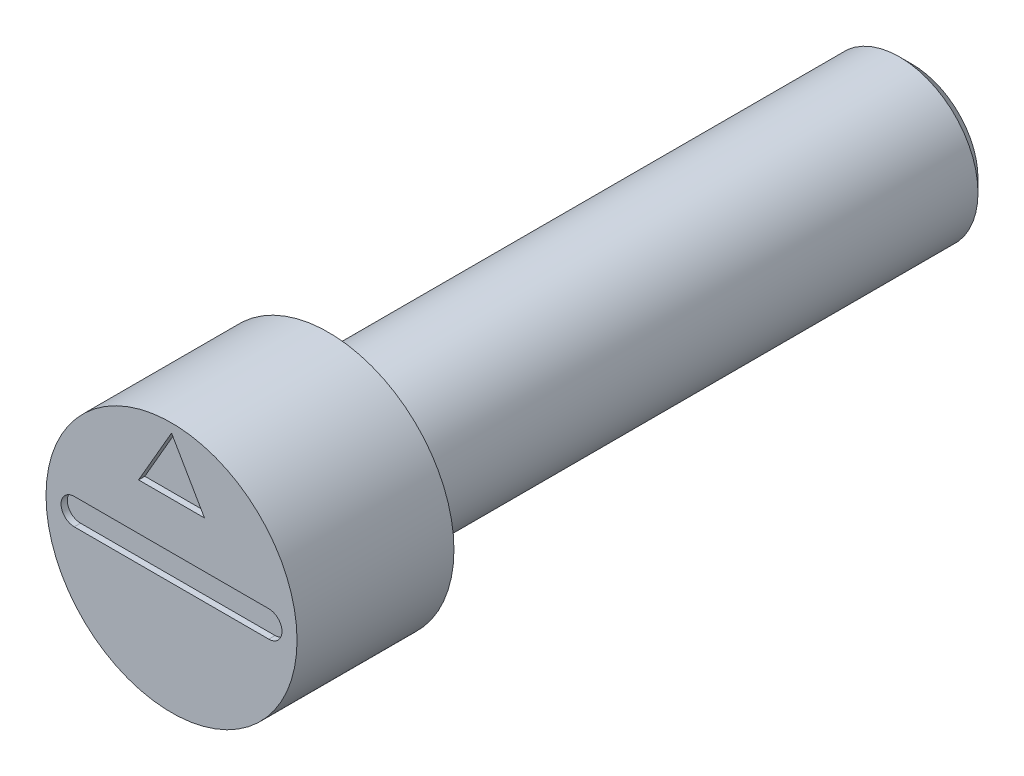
SolidWorks part; units mm, degrees
ref_plane "Front Plane" through (0, 0, 0) normal (0, 0, 1) x (1, 0, 0)
ref_plane "Top Plane" through (0, 0, 0) normal (0, 1, 0) x (1, 0, 0)
ref_plane "Right Plane" through (0, 0, 0) normal (1, 0, 0) x (0, 0, -1)
imported_body "Imported1"
other "DeleteFace1"
sketch "Sketch1" plane through (0, 0, 0) normal (0, 0, 1) x (1, 0, 0)
  line L0 (0, 1.8593) -> (-0.525, 0.95)
  line L1 (-0.525, 0.95) -> (0.525, 0.95)
  line L2 (0.525, 0.95) -> (0, 1.8593)
  line L4 (-1.55, 0.21) -> (1.55, 0.21)
  line L6 (-1.55, -0.21) -> (1.55, -0.21)
  arc A0 (-1.55, 0.21) -> (-1.55, -0.21) centre (-1.55, 0) ccw
  arc A1 (1.55, -0.21) -> (1.55, 0.21) centre (1.55, 0) ccw
  dimension "D6" = 3.52
  dimension "D1" = 1.05
  dimension "D2" = 60
  dimension "D3" = 60
  dimension "D4" = 0.42
  dimension "D5" = 0.21
  dimension "D7" = 1.76
  dimension "D8" = 0.74
extrude "Cut-Extrude1" cut sketch "Sketch1" against normal blind 0.1
sketch "Sketch2" plane through (0, 0, -15) normal (0, 0, -1) x (-1, 0, 0)
  circle A1 centre (0, 0) radius 1.25
  circle A2 centre (0, 0) radius 1.25
  dimension "D1" = 0
extrude "Cut-Extrude2" cut sketch "Sketch2" against normal offset from surface (3.2 mm away) 11.8
chamfer "Chamfer1" distance 0.2 angle 45 1 edges at (1.25, 0, -11.8)
other "Move Face1" parameters "D1"=0.5
